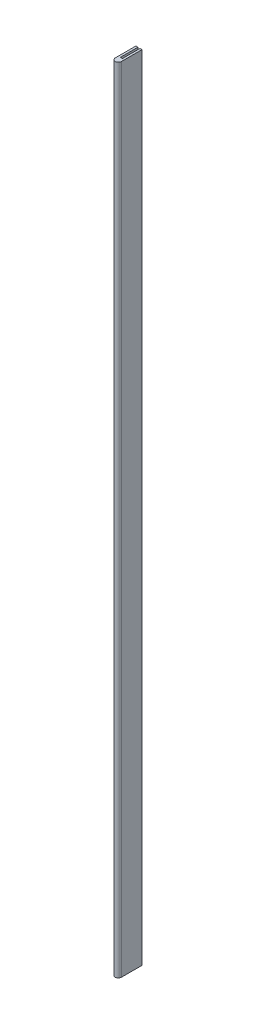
SolidWorks part; units mm, degrees
ref_plane "Bottom Plane" through (0, 0, 0) normal (0, 0, 1) x (1, 0, 0)
ref_plane "Front Plane" through (0, 0, 0) normal (0, 1, 0) x (1, 0, 0)
ref_plane "Left Plane" through (0, 0, 0) normal (1, 0, 0) x (0, 0, -1)
ref_plane "Right Plane" through (4.7625, 0, 0) normal (1, 0, 0) x (0, 0, -1)
ref_plane "Back Plane" through (0, 15.875, 0) normal (0, 1, 0) x (1, 0, 0)
ref_plane "Top Plane" through (0, 0, 63.5) normal (0, 0, 1) x (1, 0, 0)
ref_plane "Half thickness" through (0, 7.9375, 0) normal (0, 1, 0) x (1, 0, 0)
ref_plane "Half width" through (0, 0, 31.75) normal (0, 0, 1) x (1, 0, 0)
ref_plane "Half Length" through (2.3813, 0, 0) normal (1, 0, 0) x (0, 0, -1)
sketch "Sketch1" plane through (0, 0, 0) normal (0, 1, 0) x (1, 0, 0)
  circle A1 centre (0, 0) radius 2.3813
  dimension ".1875" = 4.7625
extrude "Boss-Extrude1" add sketch "Sketch1" along normal blind 609.6
sketch "Sketch2" plane through (0, 609.6, 0) normal (0, 1, 0) x (1, 0, 0)
  line L5 (-2.3813, 15.875) -> (-0.7938, 15.875)
  line L6 (-2.3813, 15.875) -> (-2.3813, 0)
  line L7 (-2.3813, 0) -> (-0.7938, 0)
  line L8 (-0.7938, 15.875) -> (-0.7938, 0)
  line L9 (-2.3813, 15.875) -> (-0.7938, 0) construction
  line L10 (-2.3813, 0) -> (-0.7938, 15.875) construction
  line L11 (0.7937, 15.875) -> (2.3812, 15.875)
  line L12 (0.7937, 15.875) -> (0.7938, 0)
  line L13 (0.7938, 0) -> (2.3813, 0)
  line L14 (2.3812, 15.875) -> (2.3813, 0)
  line L15 (0.7937, 15.875) -> (2.3813, 0) construction
  line L16 (0.7938, 0) -> (2.3812, 15.875) construction
  circle A1 centre (0, 0) radius 2.3813 construction
  point P4 (-1.5875, 7.9375)
  point P10 (1.5875, 7.9375)
  dimension "D2" = 15.875
  dimension "D1" = 1.5875
extrude "Boss-Extrude2" add sketch "Sketch2" against normal blind 609.6
ref_plane "Plane1" through (0, 304.8, 0) normal (0, 1, 0) x (1, 0, 0)
